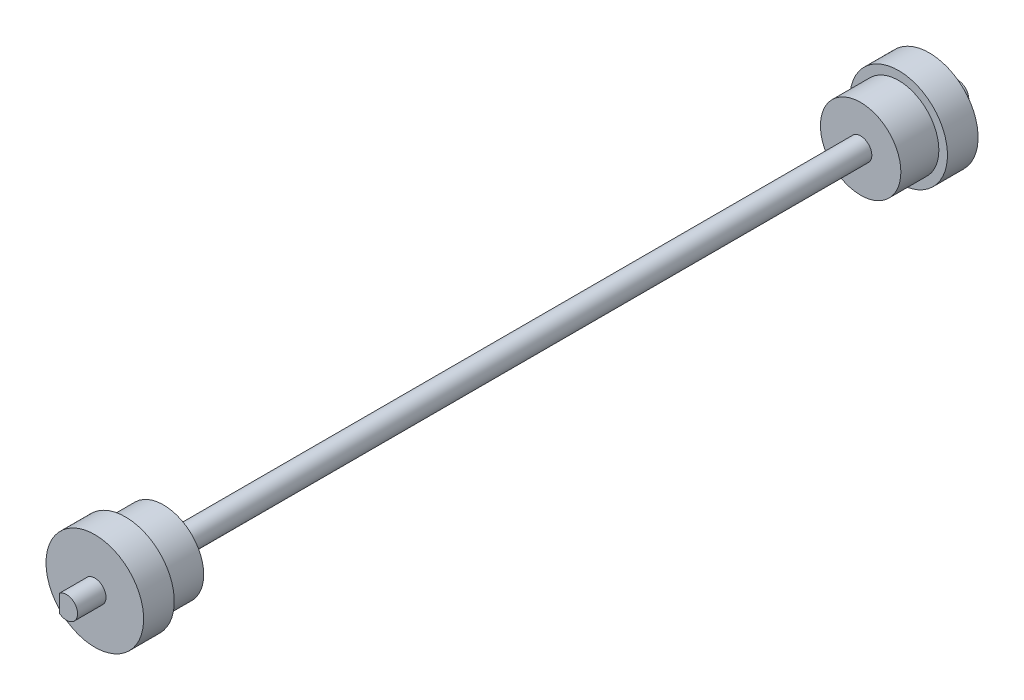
SolidWorks part; units mm, degrees
ref_plane "Front Plane" through (0, 0, 0) normal (0, 0, 1) x (1, 0, 0)
ref_plane "Top Plane" through (0, 0, 0) normal (0, 1, 0) x (1, 0, 0)
ref_plane "Right Plane" through (0, 0, 0) normal (1, 0, 0) x (0, 0, -1)
sketch "Sketch1" plane through (0, 0, 0) normal (0, 0, 1) x (1, 0, 0)
  line L0 (-1.5712, 1.9446) -> (-1.5712, -1.9446)
  line L1 (0, 5.22) -> (0, -5.22) construction
  arc A0 (-1.5712, -1.9446) -> (-1.5712, 1.9446) centre (0, 0) ccw
  point P9 (0, 0)
  dimension "D1" = 5
extrude "Boss-Extrude1" add sketch "Sketch1" along normal blind 199.39
ref_plane "Plane1" through (0, 0, 6.35) normal (0, 0, -1) x (-1, 0, 0)
sketch "Sketch2" plane through (0, 0, 6.35) normal (0, 0, -1) x (-1, 0, 0)
  circle A0 centre (0, 0) radius 10.922
  circle A1 centre (0, 0) radius 2.5
  dimension "D1" = 5
  dimension "D2" = 21.844
extrude "Boss-Extrude2" add sketch "Sketch2" against normal blind 6.858 separate body contours A0 | A1
sketch "Sketch3" plane through (0, 0, 13.208) normal (0, 0, 1) x (1, 0, 0)
  circle A0 centre (0, 0) radius 9
  circle A1 centre (0, 0) radius 2.5
  dimension "D1" = 18
  dimension "D2" = 5
extrude "Boss-Extrude3" add sketch "Sketch3" along normal blind 8.5 separate body
ref_plane "Plane2" through (0, 0, 99.695) normal (0, 0, -1) x (-1, 0, 0)
mirror "Mirror2" about plane through (0, 0, 99.695) normal (0, 0, -1) of "Boss-Extrude2", "Boss-Extrude3"
